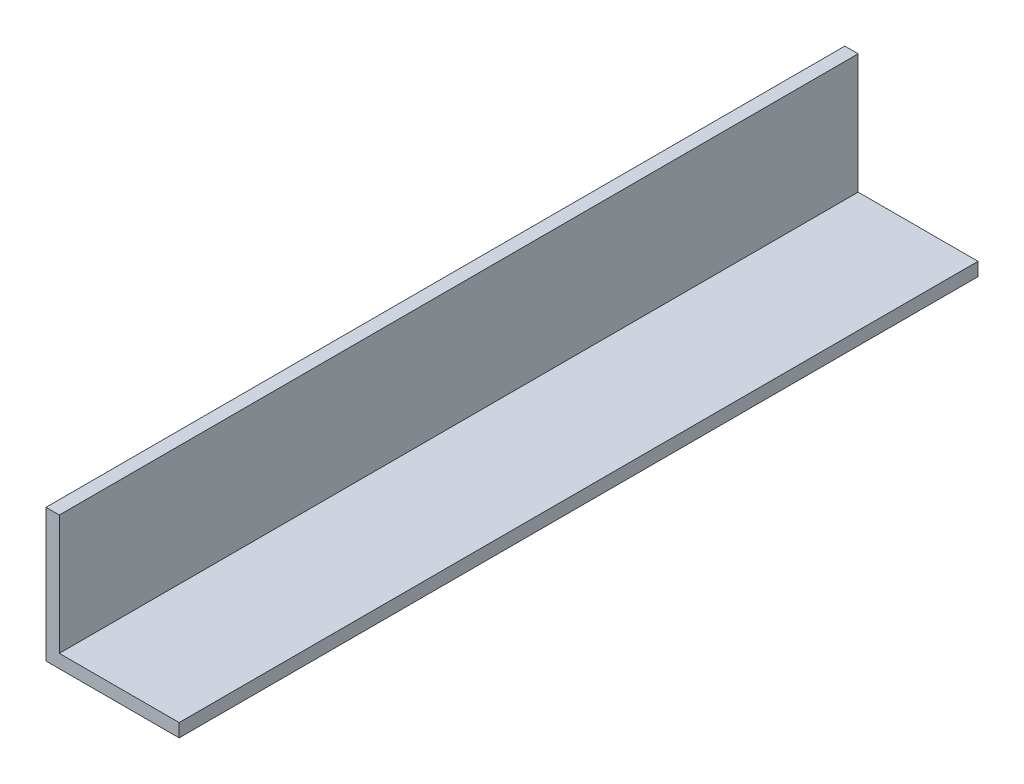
SolidWorks part; units mm, degrees
ref_plane "前视基准面" through (0, 0, 0) normal (0, 0, 1) x (1, 0, 0)
ref_plane "上视基准面" through (0, 0, 0) normal (0, 1, 0) x (1, 0, 0)
ref_plane "右视基准面" through (0, 0, 0) normal (1, 0, 0) x (0, 0, -1)
sketch "草图1" plane through (0, 0, 0) normal (0, 0, 1) x (1, 0, 0)
  line L0 (0, 0) -> (0, 45)
  line L1 (0, 45) -> (-5, 45)
  line L2 (-5, 45) -> (-5, -5)
  line L3 (-5, -5) -> (45, -5)
  line L4 (45, -5) -> (45, 0)
  line L5 (45, 0) -> (0, 0)
  dimension "D1" = 50
  dimension "D2" = 45
  dimension "D3" = 50
  dimension "D4" = 5
extrude "凸台-拉伸1" add sketch "草图1" along normal mid plane 300
